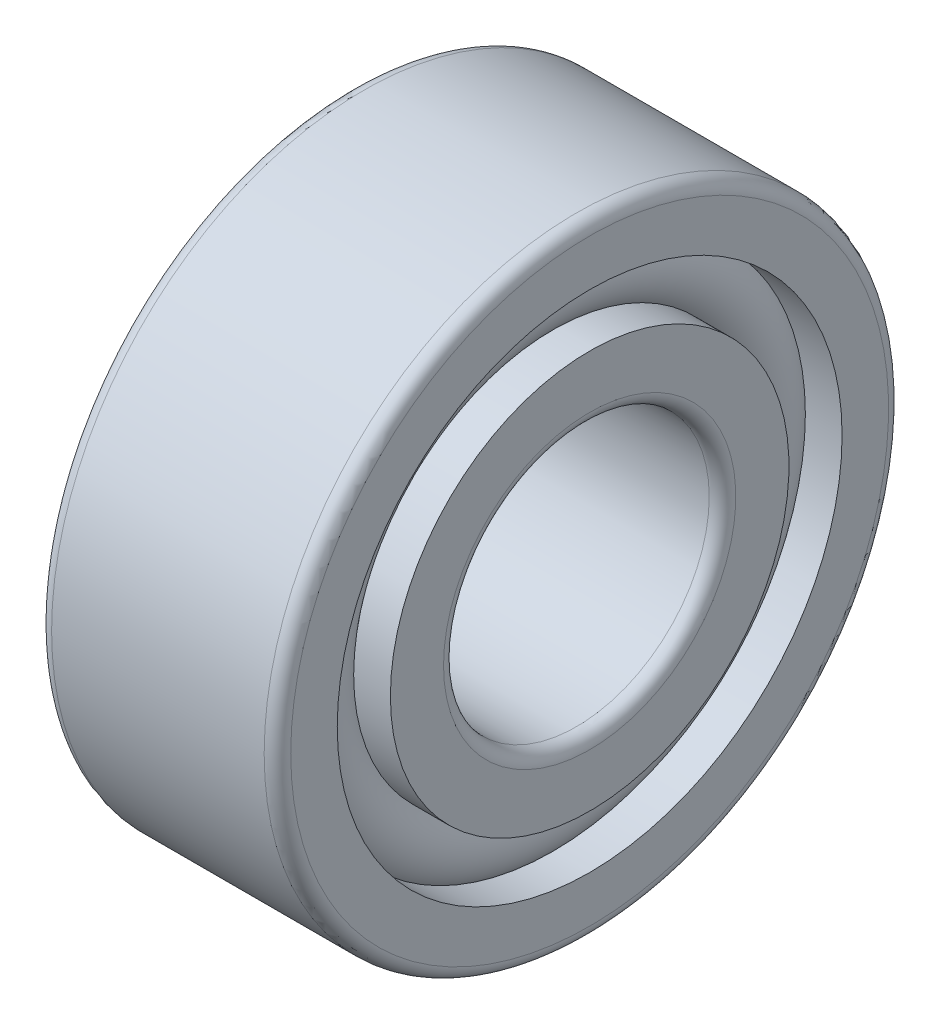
SolidWorks part; units mm, degrees
ref_plane "Plan de face" through (0, 0, 0) normal (0, 0, 1) x (1, 0, 0)
ref_plane "Plan de dessus" through (0, 0, 0) normal (0, 1, 0) x (1, 0, 0)
ref_plane "Plan de droite" through (0, 0, 0) normal (1, 0, 0) x (0, 0, -1)
sketch "Esquisse1" plane through (0, 0, 0) normal (0, 0, 1) x (1, 0, 0)
  line L0 (-10.1886, 0) -> (47.6438, 0) construction
  line L1 (0, 10) -> (0, 15)
  line L2 (0, 15) -> (2.7639, 15)
  line L3 (0, 10) -> (18, 10)
  line L4 (18, 10) -> (18, 15)
  line L5 (18, 15) -> (15.2361, 15)
  line L6 (0, 19) -> (2.7639, 19)
  line L7 (18, 19) -> (18, 23.5)
  line L8 (18, 23.5) -> (0, 23.5)
  line L9 (0, 23.5) -> (0, 19)
  line L10 (15.2361, 19) -> (18, 19)
  arc A0 (2.7639, 19) -> (2.7639, 15) centre (5, 17) ccw
  arc A1 (15.2361, 15) -> (15.2361, 19) centre (13, 17) ccw
  dimension "D6" = 5
  dimension "D7" = 6
  dimension "D1" = 20
  dimension "D2" = 15
  dimension "D3" = 19
  dimension "D4" = 47
  dimension "D5" = 5
  dimension "D8" = 18
  dimension "D9" = 6.5
revolve "Révolution1" add sketch "Esquisse1" angle 360 about L0
fillet "Congé1" radius 1 4 edges at (18, 0, 23.5) (0, 0, 23.5) (0, 0, 10) (18, 0, 10)
